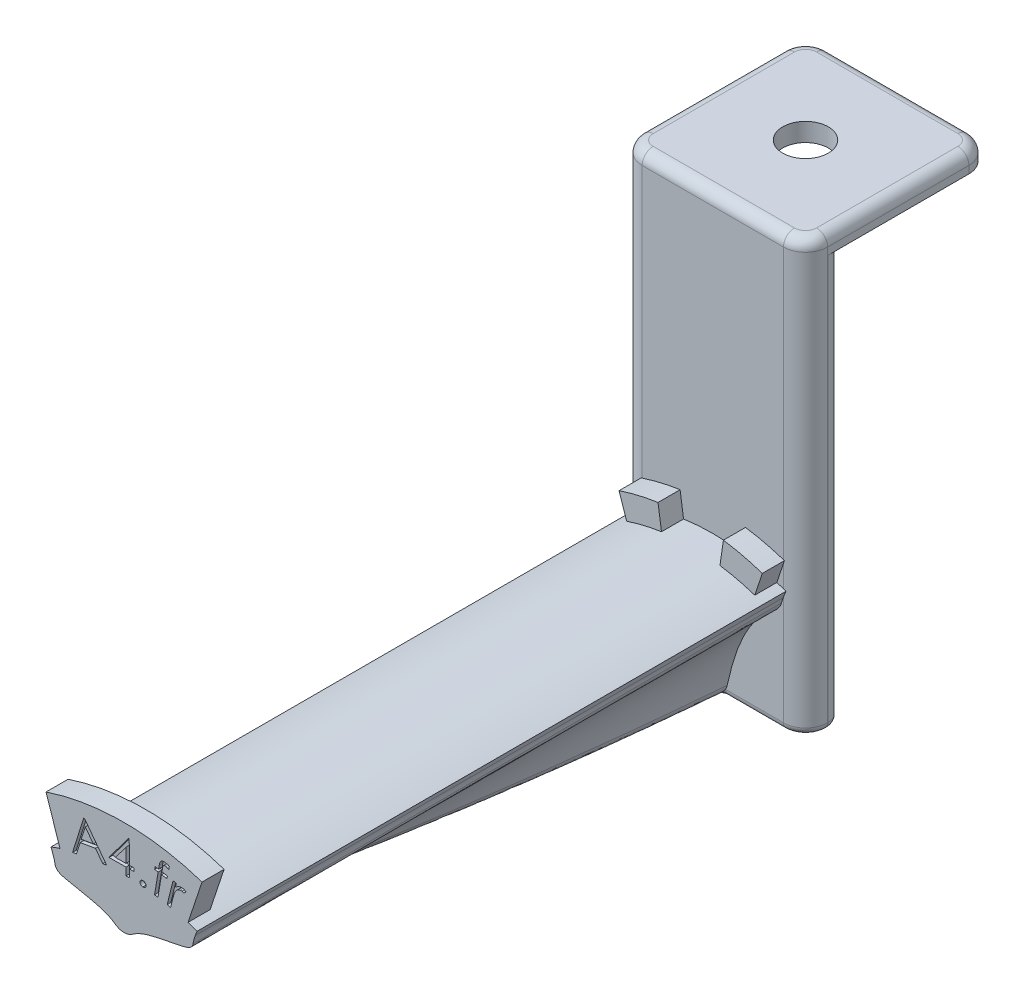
SolidWorks part; units mm, degrees
ref_plane "Plan de face" through (0, 0, 0) normal (0, 0, 1) x (1, 0, 0)
ref_plane "Plan de dessus" through (0, 0, 0) normal (0, 1, 0) x (1, 0, 0)
ref_plane "Plan de droite" through (0, 0, 0) normal (1, 0, 0) x (0, 0, -1)
sketch "Esquisse2" plane through (0, 0, 0) normal (0, 1, 0) x (1, 0, 0)
  line L0 (-12.6, 12.6) -> (12.6, 12.6) construction
  line L1 (-10.1, 10.1) -> (10.1, 10.1) construction
  line L2 (-10.1, 10.1) -> (-10.1, -10.1) construction
  line L3 (-10.1, -10.1) -> (10.1, -10.1) construction
  line L4 (10.1, 10.1) -> (10.1, -10.1) construction
  line L5 (-10.1, 10.1) -> (10.1, -10.1) construction
  line L6 (-10.1, -10.1) -> (10.1, 10.1) construction
  line L7 (12.6, 12.6) -> (12.6, -12.6) construction
  line L8 (-12.6, -12.6) -> (12.6, -12.6) construction
  line L9 (-12.6, 12.6) -> (-12.6, -12.6) construction
  line L10 (0, 20.281) -> (0, -33.1259) construction
  line L11 (-3.15, -8.2) -> (-3.15, -10.1)
  line L12 (-3.15, -8.2) -> (-5.35, -8.2)
  line L13 (-5.35, -8.2) -> (-5.35, -6.6)
  line L14 (-5.35, -6.6) -> (-2.85, -4.1)
  line L15 (2.85, -4.1) -> (-2.85, -4.1)
  line L16 (-3.15, -10.1) -> (-10.1, -10.1)
  line L17 (-10.1, -10.1) -> (-10.1, -7.5241)
  line L18 (-10.1, -7.5241) -> (-12.6, -7.5241)
  line L19 (-12.6, -7.5241) -> (-12.6, -12.6)
  line L20 (-12.6, -12.6) -> (12.6, -12.6)
  line L21 (3.15, -8.2) -> (3.15, -10.1)
  line L22 (12.6, -7.5241) -> (12.6, -12.6)
  line L23 (10.1, -7.5241) -> (12.6, -7.5241)
  line L24 (10.1, -10.1) -> (10.1, -7.5241)
  line L25 (3.15, -10.1) -> (10.1, -10.1)
  line L26 (3.15, -8.2) -> (5.35, -8.2)
  line L27 (5.35, -8.2) -> (5.35, -6.6)
  line L28 (5.35, -6.6) -> (2.85, -4.1)
  point P0 (0, 0)
  point P23 (0, -12.6)
  point P28 (0, -4.1)
  dimension "D1" = 20.2
  dimension "D2" = 20.2
  dimension "D4" = 6.3
  dimension "D5" = 1.9
  dimension "D6" = 10.7
  dimension "D7" = 1.6
  dimension "D8" = 6
  dimension "D9" = 45
  dimension "D3" = 2.5
extrude "Boss.-Extru.1" add sketch "Esquisse2" along normal blind 100
fillet "Congé1" radius 1 4 edges at (3.15, 50, 10.1) (-3.15, 50, 10.1) (10.1, 50, 10.1) (-10.1, 50, 10.1)
fillet "Congé2" radius 2 6 edges at (2.85, 50, 4.1) (-2.85, 50, 4.1) (12.6, 50, 7.5241) (-12.6, 50, 7.5241) (12.6, 50, 12.6) (-12.6, 50, 12.6)
fillet "Congé3" radius 1 2 edges at (-5.35, 50, 6.6) (5.35, 50, 6.6)
fillet "Congé4" radius 0.5 2 edges at (-5.35, 50, 8.2) (5.35, 50, 8.2)
sketch "Esquisse3" plane through (0, 100, 0) normal (0, 1, 0) x (1, 0, 0)
  line L7 (3.3287, -6.7) -> (3.3287, -6.8501)
  line L8 (2.3751, -5.7464) -> (3.3287, -6.7)
  line L14 (2.0216, -5.6) -> (-2.0216, -5.6)
  line L15 (-2.3751, -5.7464) -> (-3.3287, -6.7)
  line L16 (-3.3287, -6.7) -> (-3.3287, -6.8501)
  line L17 (-3.3287, -6.8501) -> (3.3287, -6.8501)
  line L18 (0, -2.9328) -> (0, -10.7675) construction
  arc A6 (2.0216, -5.6) -> (2.3751, -5.7464) centre (2.0216, -6.1) cw
  arc A12 (-2.0216, -5.6) -> (-2.3751, -5.7464) centre (-2.0216, -6.1) ccw
  point P4 (0, -6.8501)
  point P6 (0, -5.6)
  point P20 (2.0216, -5.6)
extrude "Enlèv. mat.-Extru.1" cut sketch "Esquisse3" against normal through all
sketch "Esquisse5" plane through (0, 0, 12.6) normal (0, 0, 1) x (1, 0, 0)
  line L0 (-45.2314, 60) -> (26.7019, 60) construction
  line L1 (-10.6, 100) -> (10.6, 100) construction
  line L2 (0, 103.8315) -> (0, -56.2067) construction
  line L3 (-36.781, 35) -> (31.5956, 35) construction
  line L4 (9.0213, 58.3156) -> (9.9234, 60.6472)
  line L5 (-9.0213, 58.3156) -> (-9.9234, 60.6472)
  arc A0 (9.0213, 58.3156) -> (-9.0213, 58.3156) centre (0, 35) ccw
  arc A1 (9.9234, 60.6472) -> (-9.9234, 60.6472) centre (0, 35) ccw
  circle A3 centre (0, 35) radius 27.5 construction
  circle A4 centre (0, 35) radius 25 construction
  point P12 (23.9076, 42.3093)
  point P15 (27.5, 35)
  dimension "D1" = 40
  dimension "D2" = 25
  dimension "D3" = 2.5
extrude "Boss.-Extru.2" add sketch "Esquisse5" along normal blind 80
sketch "Esquisse6" plane through (0, 0, 12.6) normal (0, 0, 1) x (1, 0, 0)
  line L0 (8.705, 61.0859) -> (9.7334, 64.1676)
  line L1 (0, 35) -> (0, 74.624) construction
  line L2 (3.972, 62.2116) -> (4.4412, 65.4264)
  line L3 (-3.972, 62.2116) -> (-4.4412, 65.4264)
  line L4 (-8.705, 61.0859) -> (-9.7334, 64.1676)
  arc A0 (9.7334, 64.1676) -> (4.4412, 65.4264) centre (0, 35) ccw
  arc A1 (8.705, 61.0859) -> (3.972, 62.2116) centre (0, 35) ccw
  arc A2 (-8.705, 61.0859) -> (-3.972, 62.2116) centre (0, 35) cw
  arc A3 (-9.7334, 64.1676) -> (-4.4412, 65.4264) centre (0, 35) cw
extrude "Boss.-Extru.3" add sketch "Esquisse6" along normal blind 3
sketch "Esquisse7" plane through (0, 0, 92.6) normal (0, 0, 1) x (1, 0, 0)
  line L0 (7.9104, 58.7155) -> (10.6, 66.7788)
  line L1 (10.6, 0) -> (10.6, 100) construction
  line L2 (0, 35) -> (0, 102.8123) construction
  line L3 (-7.9104, 58.7155) -> (-10.6, 66.7788)
  arc A0 (7.9104, 58.7155) -> (-7.9104, 58.7155) centre (0, 35) ccw
  arc A1 (10.6, 66.7788) -> (-10.6, 66.7788) centre (0, 35) ccw
  arc A2 (3.972, 62.2116) -> (-3.972, 62.2116) centre (0, 35) ccw construction
  dimension "D1" = 6
extrude "Boss.-Extru.4" add sketch "Esquisse7" against normal blind 3
sketch "Esquisse11" plane through (0, 100, 0) normal (0, 1, 0) x (1, 0, 0)
  line L0 (12.6, 11.8479) -> (12.6, -17.3957) construction
  line L1 (23.9231, -12.6) -> (-24.2486, -12.6) construction
  line L2 (-12.6, 10.4458) -> (-12.6, -24.5063) construction
  line L4 (-12.6, -12.6) -> (12.6, -12.6)
  line L5 (-12.6, -12.6) -> (-12.6, 12.6)
  line L6 (-12.6, 12.6) -> (12.6, 12.6)
  line L7 (12.6, -12.6) -> (12.6, 12.6)
  circle A0 centre (0, 0) radius 3.1
  dimension "D1" = 25.2
  dimension "D2" = 25.2
extrude "Boss.-Extru.7" add sketch "Esquisse11" along normal blind 2.5
sketch "Esquisse12" plane through (0, 0, 12.6) normal (0, 0, 1) x (1, 0, 0)
  line L2 (0, 72.4283) -> (0, 23.5659) construction
  arc A1 (9.3821, 59.2482) -> (-9.3821, 59.2482) centre (0, 35) ccw
  spline S0 degree 3 poles (-9.3821, 59.2482) (-9.2509, 58.1055) (-1.526, 53.6533) (-1.3477, 39.5977) (0, 35) knots 0 0 0 0 0.138707 1 1 1 1
  spline S1 degree 3 poles (9.3821, 59.2482) (9.2509, 58.1055) (1.526, 53.6533) (1.3477, 39.5977) (0, 35) knots 0 0 0 0 0.138707 1 1 1 1
sketch "Esquisse13" plane through (0, 0, 92.6) normal (0, 0, 1) x (1, 0, 0)
  line L0 (0, 72.5598) -> (0, 26.5299) construction
  arc A0 (9.3821, 59.2482) -> (-9.3821, 59.2482) centre (0, 35) ccw
  spline S0 degree 3 poles (-9.3821, 59.2482) (-9.4951, 58.2404) (-3.8684, 56.968) (-1.6203, 56.8757) (0, 54.7632) knots 0 0 0 0 0.16558 1 1 1 1
  spline S1 degree 3 poles (9.3821, 59.2482) (9.4951, 58.2404) (3.8684, 56.968) (1.6203, 56.8757) (0, 54.7632) knots 0 0 0 0 0.16558 1 1 1 1
loft "Lissage2" add profiles "Esquisse12", "Esquisse13"
fillet "Congé6" radius 3 4 edges at (12.6, 101.25, 12.6) (-12.6, 101.25, 12.6) (-12.6, 101.25, -12.6) (12.6, 101.25, -12.6)
fillet "Congé7" radius 2 1 edges
sketch "Esquisse16" plane through (0, 0, 0) normal (0, -1, 0) x (1, 0, 0)
  line L1 (19.9941, 22.9893) -> (-20.0341, 22.9893)
  line L2 (19.9941, 22.9893) -> (19.9941, -7.4975)
  line L3 (19.9941, -7.4975) -> (-20.0341, -7.4975)
  line L4 (-20.0341, 22.9893) -> (-20.0341, -7.4975)
extrude "Enlèv. mat.-Extru.3" cut sketch "Esquisse16" against normal up to vertex
fillet "Congé8" radius 1 39 edges at (2.2129, 44.0237, 5.6381) (2.8519, 44.0237, 6.2232) (3.3287, 44.0237, 6.7751) (0, 44.0237, 6.8501) (-3.3287, 44.0237, 6.7751) (-2.8519, 44.0237, 6.2232) (-2.2129, 44.0237, 5.6381) (0, 44.0237, 5.6) (5.35, 44.0237, 7.3571) (5.2739, 44.0237, 6.6315) (4.2464, 44.0237, 5.4964) (2.7869, 44.0237, 4.2522) (0, 44.0237, 4.1) (-2.7869, 44.0237, 4.2522) (-4.2464, 44.0237, 5.4964) (-5.2739, 44.0237, 6.6315) (-5.35, 44.0237, 7.3571) (-5.2036, 44.0237, 8.0536) (-4, 44.0237, 8.2) (-3.15, 44.0237, 8.65) (-3.4429, 44.0237, 9.8071) (-6.625, 44.0237, 10.1) (-9.8071, 44.0237, 9.8071) (-10.1, 44.0237, 8.3121) (-12.0142, 44.0237, 8.1099) (-12.6, 44.0237, 9.5621) (-11.7213, 44.0237, 11.7213) (-4.8, 44.0237, 12.6) (4.8, 44.0237, 12.6) (11.7213, 44.0237, 11.7213) (12.6, 44.0237, 9.5621) (12.0142, 44.0237, 8.1099) (10.1, 44.0237, 8.3121) (9.8071, 44.0237, 9.8071) (6.625, 44.0237, 10.1) (3.4429, 44.0237, 9.8071) (3.15, 44.0237, 8.65) (4, 44.0237, 8.2) (5.2036, 44.0237, 8.0536)
fillet "Congé9" radius 1.5 8 edges at (12.6, 102.5, 0) (0, 102.5, 12.6) (-12.6, 102.5, 0) (0, 102.5, -12.6) (11.7213, 102.5, -11.7213) (-11.7213, 102.5, -11.7213) (-11.7213, 102.5, 11.7213) (11.7213, 102.5, 11.7213)
fillet "Congé10" radius 6 2 edges
sketch "Esquisse17" plane through (0, 0, 92.6) normal (0, 0, 1) x (1, 0, 0)
  line L0 (0, 35) -> (-9.7976, 64.3733) construction
  line L1 (0, 35) -> (8.8537, 66.1199) construction
  line L2 (-10.6, 66.7788) -> (-8.7015, 61.087) construction
  arc A0 (7.4969, 61.3509) -> (-8.6688, 60.989) centre (0, 35) ccw construction
  text T0 "A4.fr" font "Century Gothic" height 4.5
extrude "Enlèv. mat.-Extru.4" cut sketch "Esquisse17" against normal blind 0.5
